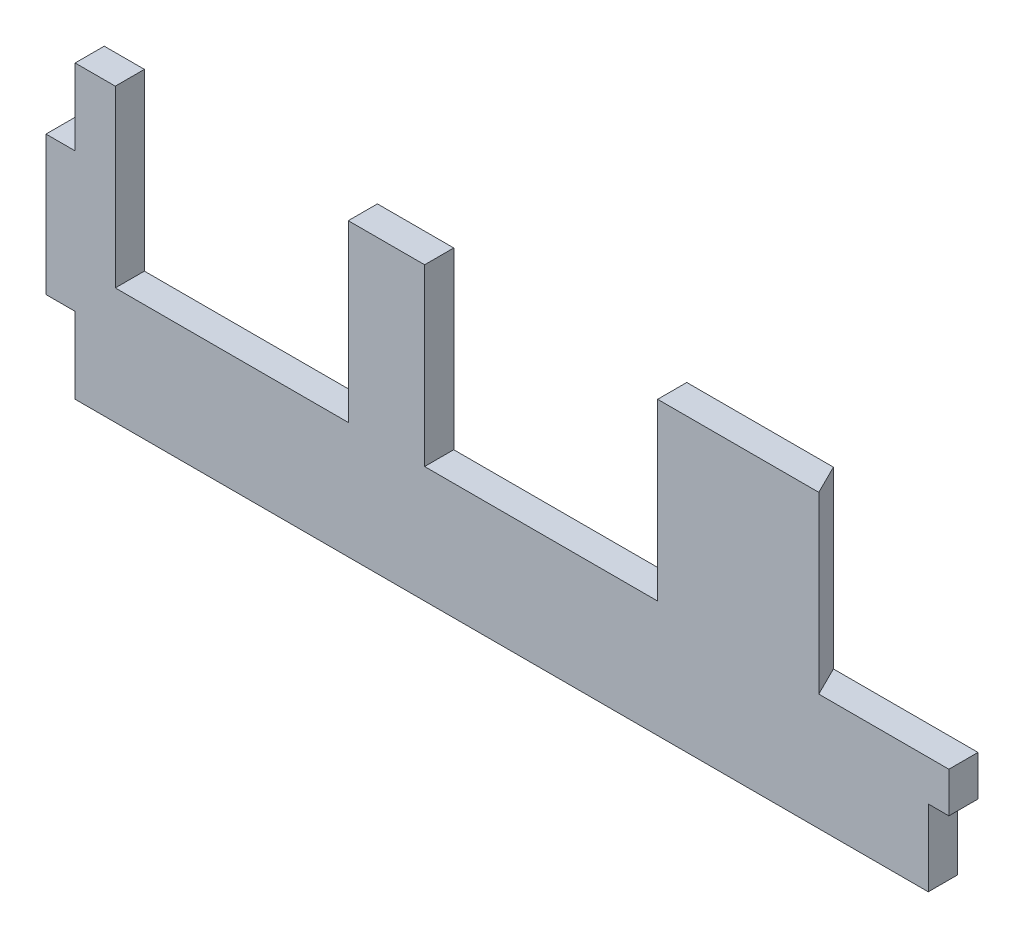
SolidWorks part; units mm, degrees
ref_plane "Front Plane" through (0, 0, 0) normal (0, 0, 1) x (1, 0, 0)
ref_plane "Top Plane" through (0, 0, 0) normal (0, 1, 0) x (1, 0, 0)
ref_plane "Right Plane" through (0, 0, 0) normal (1, 0, 0) x (0, 0, -1)
sketch "Sketch2" plane through (0, 0, 0) normal (0, 0, 1) x (1, 0, 0)
  line L0 (393.7, 50.8) -> (393.7, 33.1905) construction
  line L1 (393.7, 127) -> (393.7, 33.1905)
  line L4 (393.7, 33.1905) -> (384.7197, 33.1905) construction
  line L5 (384.7197, 33.1905) -> (384.7197, 0) construction
  line L8 (0, 127) -> (30.2092, 127) construction
  line L9 (12.7, 127) -> (393.7, 127)
  line L10 (393.7, 33.1905) -> (384.7197, 33.1905)
  line L11 (384.7197, 33.1905) -> (384.7197, 0)
  line L12 (12.7, 33.1905) -> (12.7, 0) construction
  line L13 (12.7, 33.1905) -> (0, 33.1905) construction
  line L14 (0, 93.8095) -> (0, 33.1905) construction
  line L15 (12.7, 127) -> (12.7, 93.8095) construction
  line L16 (12.7, 93.8095) -> (0, 93.8095) construction
  line L17 (12.7, 0) -> (384.7197, 0)
  line L19 (12.7, 33.1905) -> (12.7, 0)
  line L20 (12.7, 33.1905) -> (0, 33.1905)
  line L22 (0, 93.8095) -> (0, 33.1905)
  line L24 (12.7, 127) -> (12.7, 93.8095)
  line L25 (12.7, 93.8095) -> (0, 93.8095)
extrude "Extrude1" add sketch "Sketch2" against normal blind 12.7
sketch "Sketch3" plane through (0, 127, 0) normal (0, 1, 0) x (1, 0, 0)
  line L0 (393.7, 12.7) -> (12.7, 12.7) construction
  line L1 (165.1, 12.7) -> (266.7, 12.7)
  line L2 (165.1, 12.7) -> (165.1, 0)
  line L3 (165.1, 0) -> (266.7, 0)
  line L4 (266.7, 12.7) -> (266.7, 0)
  line L5 (393.7, 0) -> (12.7, 0) construction
  line L6 (330.658, 12.7) -> (393.7, 12.7)
  line L7 (30.2092, 12.7) -> (131.8092, 12.7)
  line L8 (30.2092, 12.7) -> (30.2092, 0)
  line L9 (30.2092, 0) -> (131.8092, 0)
  line L10 (131.8092, 12.7) -> (131.8092, 0)
  line L11 (393.7, 12.7) -> (393.7, 0)
  line L12 (393.7, 0) -> (336.9706, 0)
  line L13 (336.9706, 0) -> (330.658, 12.7)
  line L14 (266.7, 0) -> (266.7, 76.6513) construction
  line L15 (131.8092, 0) -> (131.8092, 76.2) construction
  line L16 (310.1097, 54.04) -> (336.9706, 0) construction
  line L17 (165.1, 76.6513) -> (165.1, 0) construction
  line L18 (30.2092, 76.2) -> (30.2092, 0) construction
extrude "Cut-Extrude1" cut sketch "Sketch3" against normal blind 76.2
